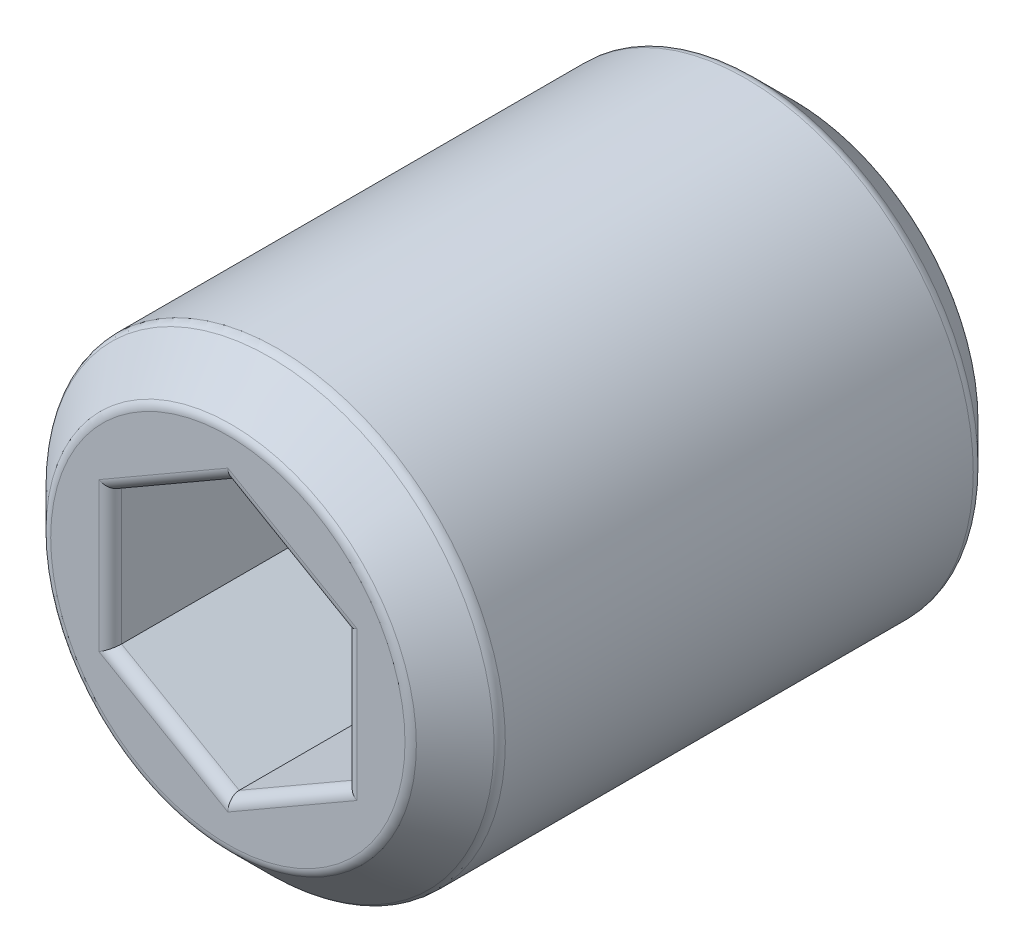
SolidWorks part; units mm, degrees
ref_plane "Plan1" through (0, 0, 0) normal (0, 0, 1) x (1, 0, 0)
ref_plane "Plan2" through (0, 0, 0) normal (0, 1, 0) x (1, 0, 0)
ref_plane "Plan3" through (0, 0, 0) normal (1, 0, 0) x (0, 0, -1)
sketch "Esquisse1" plane through (0, 0, 0) normal (0, 0, 1) x (1, 0, 0)
  circle A0 centre (0, 0) radius 2
  dimension "D1" = 4
extrude "Extrusion1" add sketch "Esquisse1" along normal blind 5
chamfer "Chanfrein1" distance 0.4 angle 45
sketch "Esquisse2" plane through (0, 0, 5) normal (0, 0, 1) x (1, 0, 0)
  line L1 (0, 1.1949) -> (-1.0348, 0.5975)
  line L2 (-1.0348, 0.5975) -> (-1.0348, -0.5975)
  line L3 (-1.0348, -0.5975) -> (0, -1.1949)
  line L4 (0, -1.1949) -> (1.0348, -0.5975)
  line L5 (1.0348, -0.5975) -> (1.0348, 0.5975)
  line L6 (1.0348, 0.5975) -> (0, 1.1949)
  circle A0 centre (0, 0) radius 1.0348 construction
extrude "Enlèv. mat.-Extru.1" cut sketch "Esquisse2" against normal blind 2
fillet "Congé1" radius 0.1
